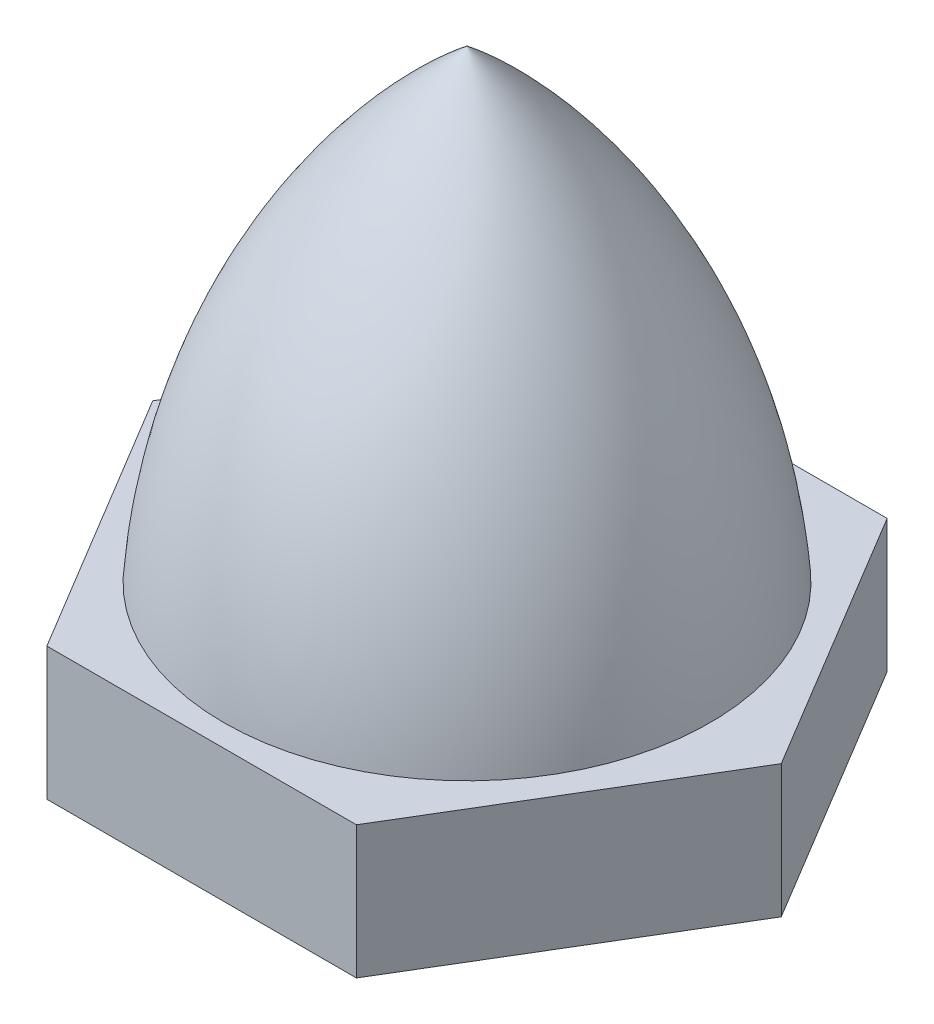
SolidWorks part; units mm, degrees
ref_plane "XY" through (0, 0, 0) normal (0, 0, 1) x (1, 0, 0)
ref_plane "XZ" through (0, 0, 0) normal (0, 1, 0) x (1, 0, 0)
ref_plane "YZ" through (0, 0, 0) normal (1, 0, 0) x (0, 0, -1)
sketch "Esquisse1" plane through (0, 0, 0) normal (0, 0, 1) x (1, 0, 0)
  line L0 (0, 10.5) -> (0, -10.5) construction
  line L1 (0, 0) -> (5.5, 0)
  line L2 (0, 10.5) -> (0, 0)
  arc A0 (5.5, 0) -> (0, 10.5) centre (-9.4563, -1.1438) ccw
  dimension "D3" = 15
  dimension "D1" = 10.5
  dimension "D2" = 5.5
revolve "cône" add sketch "Esquisse1" angle 360 about L0
sketch "Esquisse2" plane through (0, 0, 0) normal (0, -1, 0) x (1, 0, 0)
  line L0 (-3.5, 6) -> (3.5, 6)
  line L1 (-3.5, -6) -> (3.5, -6)
  line L2 (0, 6) -> (0, -6) construction
  line L3 (3.5, -6) -> (7.1056, 0)
  line L4 (3.5, 6) -> (7.1056, 0)
  line L5 (-3.5, 6) -> (-7.1056, 0)
  line L6 (-7.1056, 0) -> (-3.5, -6)
  point P2 (0, 6)
  dimension "D1" = 7
  dimension "D2" = 12
  dimension "D3" = 7
extrude "ecrou " add sketch "Esquisse2" along normal blind 3
sketch "Esquisse3" plane through (0, -3, 0) normal (0, -1, 0) x (1, 0, 0)
  circle A0 centre (0, 0) radius 2.5
  dimension "D1" = 5
extrude "passage axe moteur" cut sketch "Esquisse3" against normal blind 10.5
